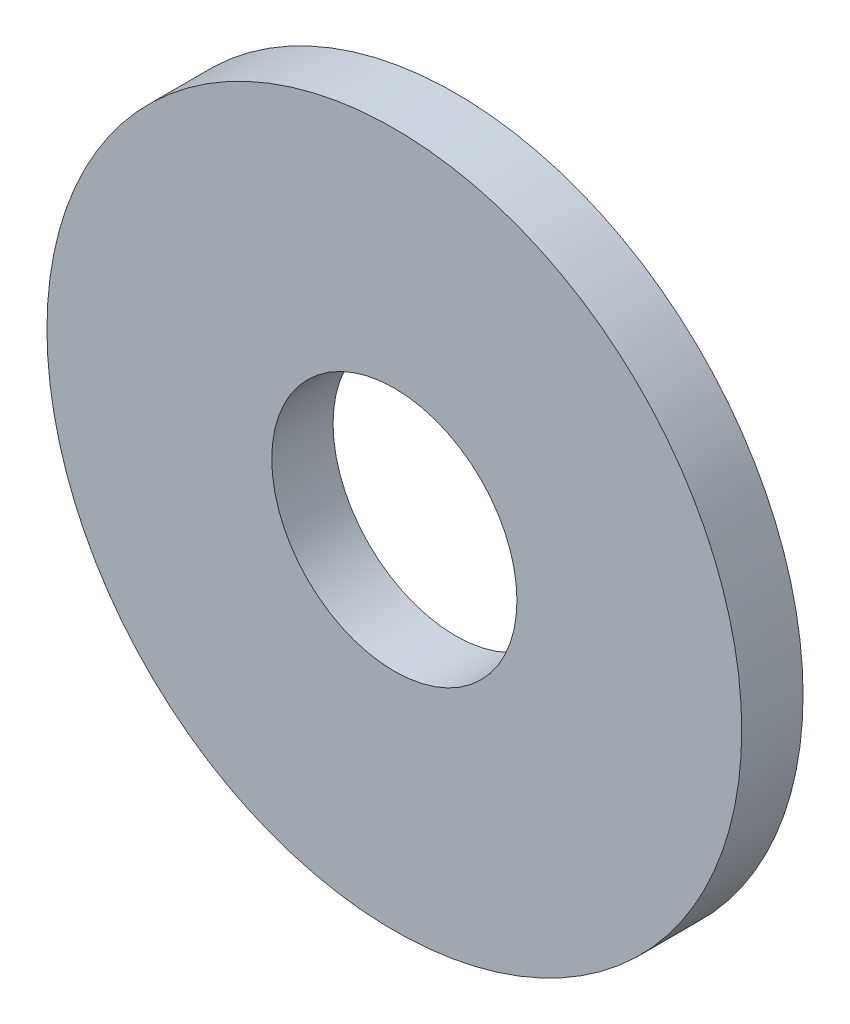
SolidWorks part; units mm, degrees
ref_plane "Plan de face" through (0, 0, 0) normal (0, 0, 1) x (1, 0, 0)
ref_plane "Plan de dessus" through (0, 0, 0) normal (0, 1, 0) x (1, 0, 0)
ref_plane "Plan de droite" through (0, 0, 0) normal (1, 0, 0) x (0, 0, -1)
sketch "Esquisse1" plane through (0, 0, 0) normal (0, 0, 1) x (1, 0, 0)
  circle A0 centre (0, 0) radius 8.5
  circle A1 centre (0, 0) radius 3
  dimension "D1" = 17
  dimension "D2" = 6
extrude "Extrusion1" add sketch "Esquisse1" along normal blind 1.5
